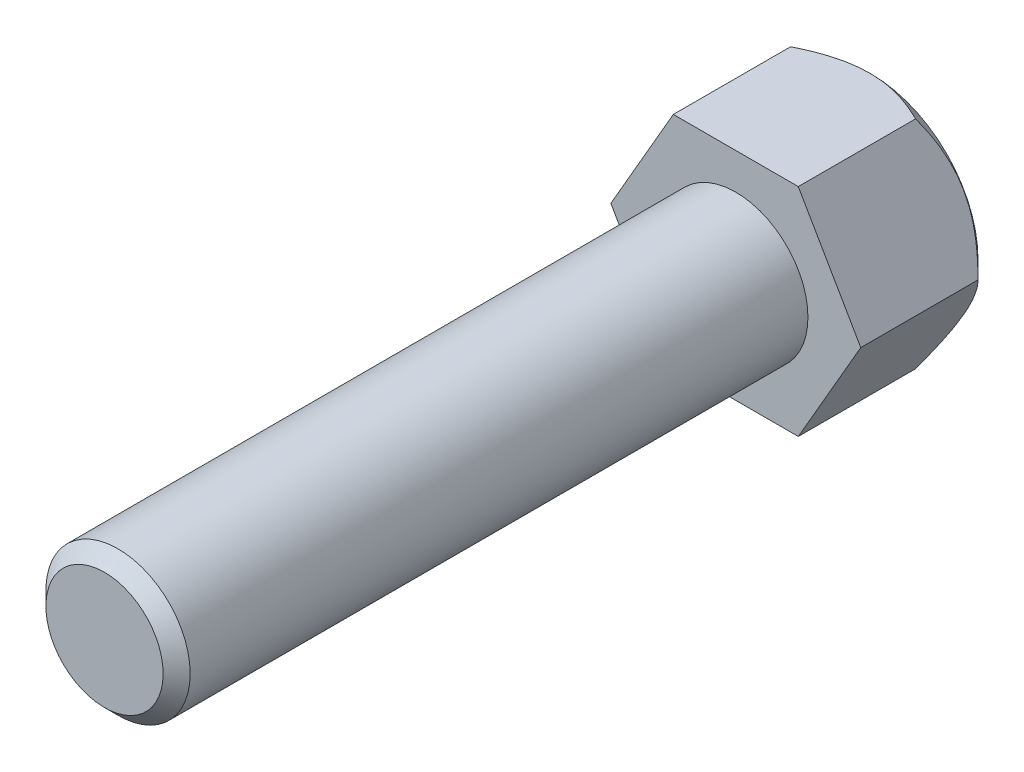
SolidWorks part; units mm, degrees
ref_plane "Plan de face" through (0, 0, 0) normal (0, 0, 1) x (1, 0, 0)
ref_plane "Plan de dessus" through (0, 0, 0) normal (0, 1, 0) x (1, 0, 0)
ref_plane "Plan de droite" through (0, 0, 0) normal (1, 0, 0) x (0, 0, -1)
sketch "Esquisse1" plane through (0, 0, 0) normal (0, 0, 1) x (1, 0, 0)
  line L1 (13.8564, 0) -> (6.9282, 12)
  line L2 (6.9282, 12) -> (-6.9282, 12)
  line L3 (-6.9282, 12) -> (-13.8564, 0)
  line L4 (-13.8564, 0) -> (-6.9282, -12)
  line L5 (-6.9282, -12) -> (6.9282, -12)
  line L6 (6.9282, -12) -> (13.8564, 0)
  circle A0 centre (0, 0) radius 12 construction
  dimension "D1" = 24
extrude "Boss.-Extru.1" add sketch "Esquisse1" along normal blind 15
sketch "Esquisse2" plane through (0, 0, 15) normal (0, 0, 1) x (1, 0, 0)
  circle A0 centre (0, 0) radius 8
  dimension "D1" = 16
extrude "Boss.-Extru.2" add sketch "Esquisse2" along normal blind 70
chamfer "Chanfrein1" distance 1.5 angle 45 1 edges at (8, 0, 85)
sketch "Esquisse3" plane through (0, 0, 0) normal (0, 1, 0) x (1, 0, 0)
  line L0 (13.8564, 0) -> (11.8564, 0)
  line L2 (11.8564, 0) -> (13.8564, -2)
  line L3 (13.8564, -15) -> (13.8564, 0) construction
  line L4 (13.8564, -2) -> (13.8564, 0)
  line L5 (0, 0) -> (0, -8.3477) construction
  dimension "D1" = 2
  dimension "D2" = 2
revolve "Enlèvement de matière-Révolution1" cut sketch "Esquisse3" angle 360 about L5
